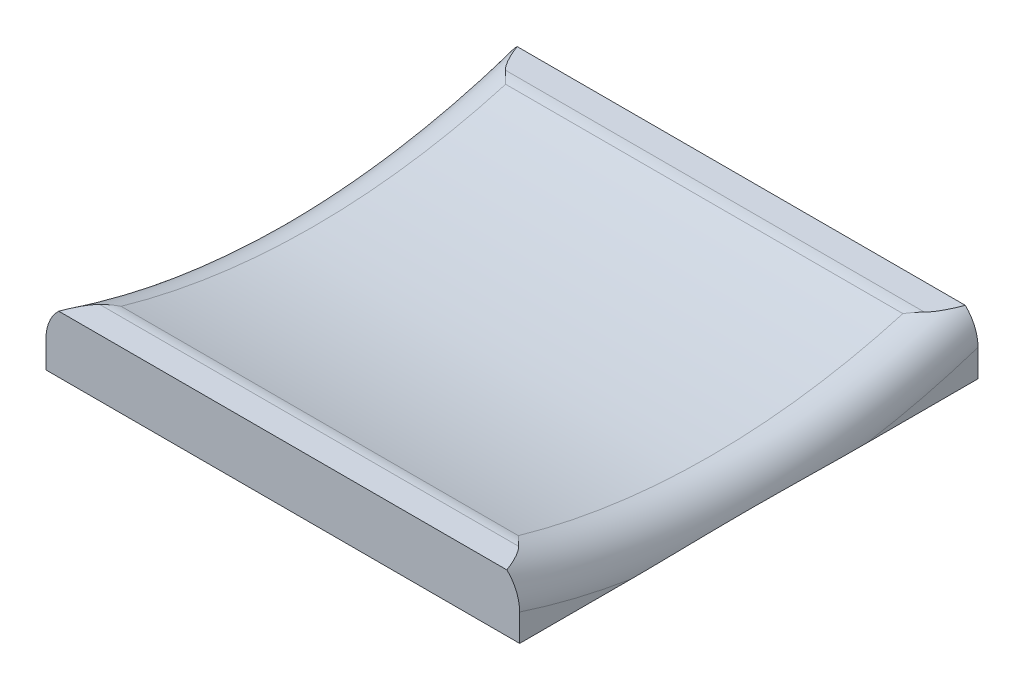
SolidWorks part; units mm, degrees
ref_plane "Front Plane" through (0, 0, 0) normal (0, 0, 1) x (1, 0, 0)
ref_plane "Top Plane" through (0, 0, 0) normal (0, 1, 0) x (1, 0, 0)
ref_plane "Right Plane" through (0, 0, 0) normal (1, 0, 0) x (0, 0, -1)
sketch "Sketch1" plane through (0, 0, 0) normal (1, 0, 0) x (0, 0, -1)
  line L1 (-76.2, 9.525) -> (76.2, 9.525)
  line L2 (-76.2, 9.525) -> (-76.2, -9.525)
  line L3 (-76.2, -9.525) -> (76.2, -9.525)
  line L4 (76.2, 9.525) -> (76.2, -9.525)
  line L5 (-76.2, 9.525) -> (76.2, -9.525) construction
  line L6 (-76.2, -9.525) -> (76.2, 9.525) construction
  point P0 (0, 0)
  dimension "D1" = 152.4
  dimension "D2" = 19.05
extrude "Boss-Extrude1" add sketch "Sketch1" along normal mid plane 157.48
sketch "Sketch2" plane through (0, 0, 0) normal (1, 0, 0) x (0, 0, -1)
  line L0 (-76.2, 9.525) -> (-76.2, -9.525) construction
  line L1 (76.2, 9.525) -> (-76.2, 9.525) construction
  arc A0 (-73.66, 12.065) -> (73.66, 12.065) centre (0, 230.8893) ccw
  point P8 (0, 0)
  dimension "D1" = 2.54
  dimension "D2" = 2.54
extrude "Cut-Extrude1" cut sketch "Sketch2" against normal through all and the other way through all
fillet "Fillet1" radius 12.7 4 edges at (-78.74, 0, 0) (78.74, 0, 0) (0, 9.525, -65.6332) (0, 9.525, 65.6332)
ref_plane "Plane1" through (0, 26.035, 0) normal (0, -1, 0) x (-1, 0, 0)
sketch "O-Ring Path" plane through (0, 26.035, 0) normal (0, -1, 0) x (-1, 0, 0)
  line L0 (-66.04, -63.9344) -> (66.04, 63.9344) construction
  arc A0 (34.9638, 33.849) -> (-39.3932, -38.1373) centre (-23.1083, 19.4375) cw construction
  arc A1 (-44.2752, -55.397) -> (52.3726, 38.1693) centre (-23.1083, 19.4375) ccw
  arc A2 (-34.5113, -20.8775) -> (17.555, 29.5288) centre (-23.1083, 19.4375) ccw
  arc A3 (-34.5113, -20.8775) -> (-44.2752, -55.397) centre (-39.3932, -38.1373) ccw
  arc A4 (52.3726, 38.1693) -> (17.555, 29.5288) centre (34.9638, 33.849) ccw
  point P4 (18.5096, -23.551)
  dimension "D3" = 59.8336
  dimension "D1" = 35.8738
  dimension "D2" = 119.731
